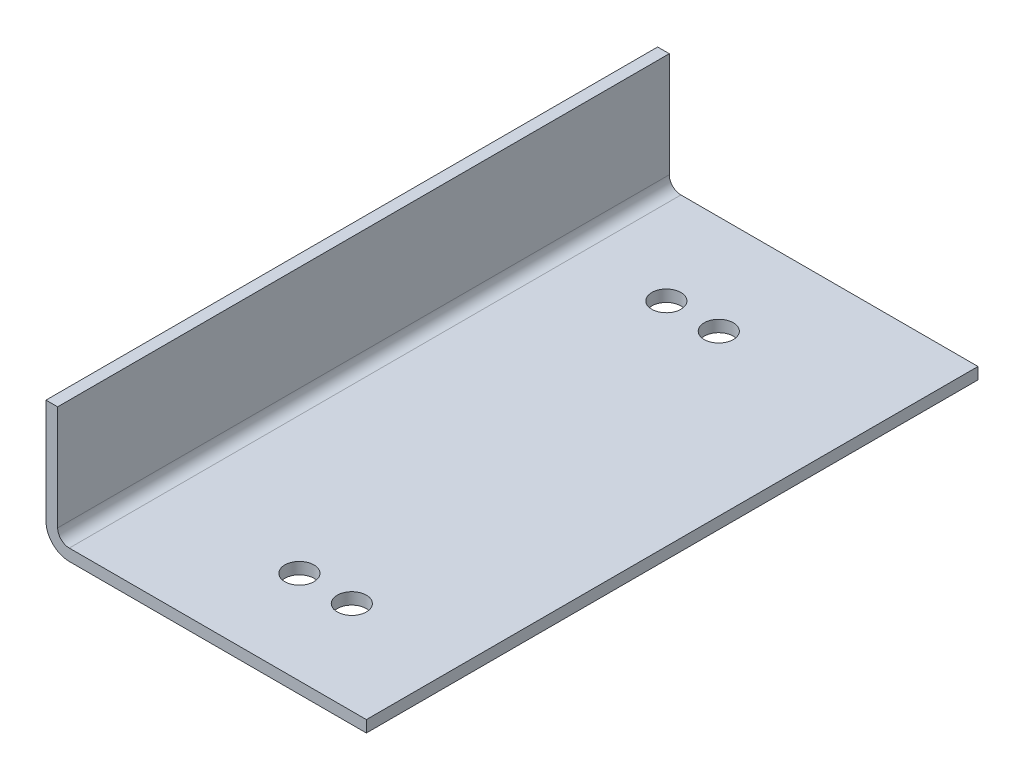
SolidWorks part; units mm, degrees
ref_plane "Plan de face" through (0, 0, 0) normal (0, 0, 1) x (1, 0, 0)
ref_plane "Plan de dessus" through (0, 0, 0) normal (0, 1, 0) x (1, 0, 0)
ref_plane "Plan de droite" through (0, 0, 0) normal (1, 0, 0) x (0, 0, -1)
sketch "Esquisse1" plane through (0, 0, 0) normal (0, 0, 1) x (1, 0, 0)
  line L0 (0, 4) -> (0, 22)
  line L1 (4, 0) -> (55, 0)
  line L2 (55, 0) -> (55, 2)
  line L3 (55, 2) -> (4, 2)
  line L4 (2, 4) -> (2, 22)
  line L5 (2, 22) -> (0, 22)
  arc A0 (4, 2) -> (2, 4) centre (4, 4) cw
  arc A1 (0, 4) -> (4, 0) centre (4, 4) ccw
  point P11 (0, 0)
  dimension "D5" = 2
  dimension "D6" = 4
  dimension "D1" = 55
  dimension "D2" = 2
  dimension "D3" = 2
  dimension "D4" = 22
extrude "Extrusion1" add sketch "Esquisse1" along normal blind 105
sketch "Esquisse2" plane through (0, 0, 0) normal (0, -1, 0) x (1, 0, 0)
  line L0 (55, 105) -> (55, 0) construction
  line L1 (4, 0) -> (55, 0) construction
  circle A0 centre (18.5, 17) radius 2.5
  circle A1 centre (27.5, 17) radius 2.5
  circle A2 centre (36.5, 17) radius 2.5
  circle A3 centre (27.5, 17) radius 2.5
  circle A4 centre (27.5, 89) radius 2.5
  circle A5 centre (18.5, 89) radius 2.5
  circle A6 centre (36.5, 89) radius 2.5
  circle A7 centre (27.5, 89) radius 2.5
  dimension "D3" = 9
  dimension "D4" = 5
  dimension "D5" = 5
  dimension "D1" = 27.5
  dimension "D2" = 17
extrude "Enlèv. mat.-Extru.1" cut sketch "Esquisse2" against normal up to next
